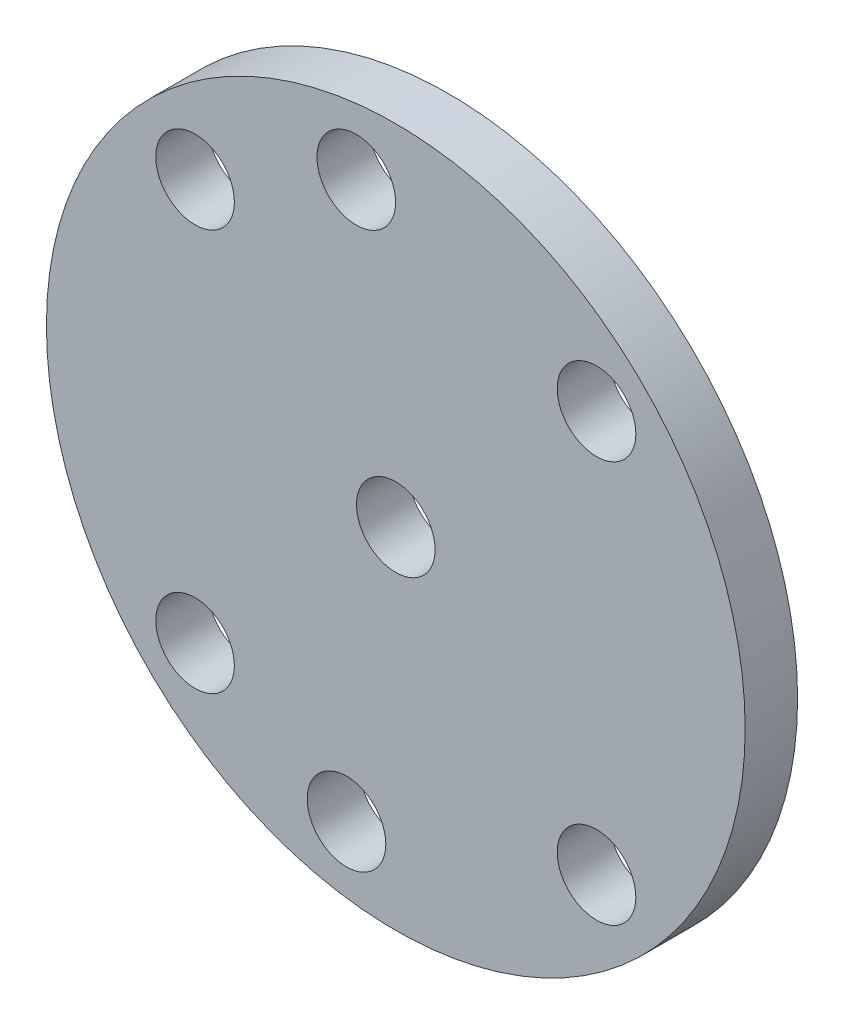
SolidWorks part; units mm, degrees
ref_plane "Plan de face" through (0, 0, 0) normal (0, 0, 1) x (1, 0, 0)
ref_plane "Plan de dessus" through (0, 0, 0) normal (0, 1, 0) x (1, 0, 0)
ref_plane "Plan de droite" through (0, 0, 0) normal (1, 0, 0) x (0, 0, -1)
sketch "Esquisse1" plane through (0, 0, 0) normal (0, 0, 1) x (1, 0, 0)
  line L0 (-58.0879, 0) -> (58.0879, 0) construction
  line L1 (0, -146.2818) -> (0, 146.2818) construction
  line L2 (32.5269, 32.5269) -> (-32.5269, -32.5269) construction
  line L3 (-32.5269, 32.5269) -> (32.7803, -32.7803) construction
  line L4 (-7.0055, 49.8465) -> (0.949, -6.7523) construction
  line L5 (1.1014, 6.2465) -> (-9.0002, -51.0428) construction
  circle A0 centre (0, 0) radius 40
  circle A1 centre (0, 0) radius 32.5 construction
  circle A2 centre (22.981, -22.981) radius 4.5
  circle A3 centre (22.981, 22.981) radius 4.5
  circle A4 centre (-22.981, 22.981) radius 4.5
  circle A5 centre (-22.981, -22.981) radius 4.5
  circle A6 centre (-5.6436, -32.0063) radius 4.5
  circle A7 centre (-4.5231, 32.1837) radius 4.5
  circle A8 centre (0, 0) radius 4.5
  dimension "D1" = 80
  dimension "D2" = 65
  dimension "D3" = 9
  dimension "D4" = 9
  dimension "D5" = 9
  dimension "D6" = 9
  dimension "D7" = 9
  dimension "D8" = 9
  dimension "D13" = 9
  dimension "D9" = 10
  dimension "D10" = 45
  dimension "D11" = 45
  dimension "D12" = 8
extrude "Extrusion1" add sketch "Esquisse1" along normal blind 6
